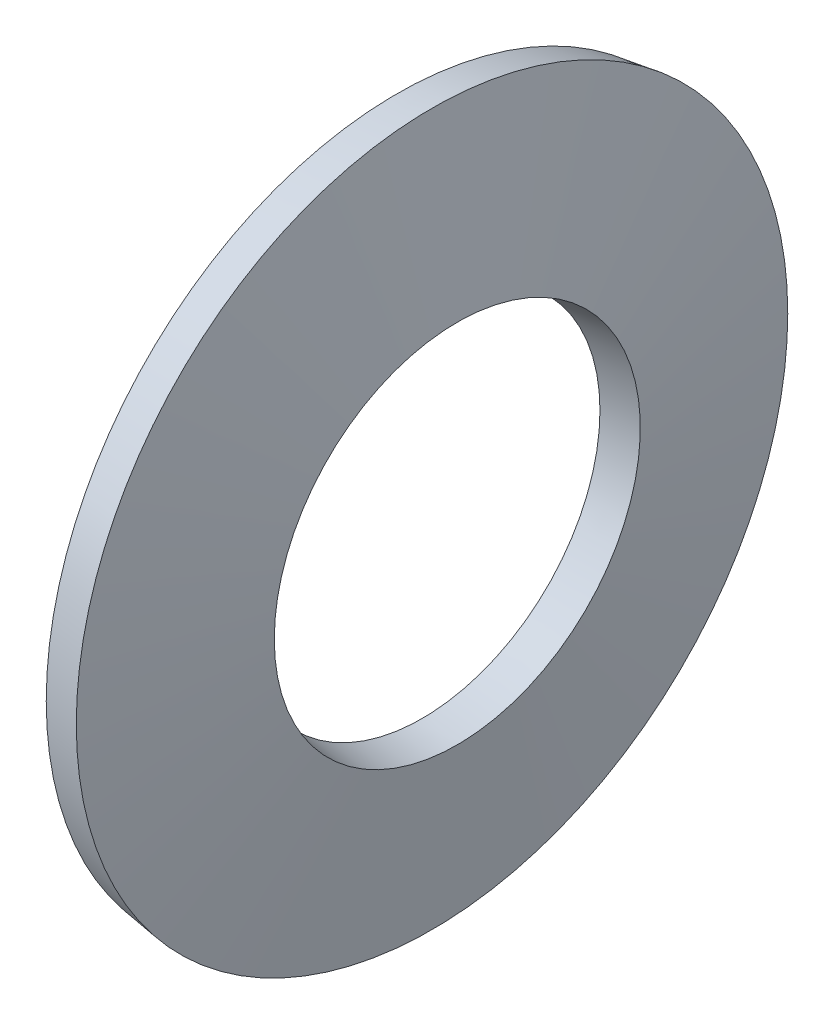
SolidWorks part; units mm, degrees
ref_plane "Plan1" through (0, 0, 0) normal (0, 0, 1) x (1, 0, 0)
ref_plane "Plan2" through (0, 0, 0) normal (0, 1, 0) x (1, 0, 0)
ref_plane "Plan3" through (0, 0, 0) normal (1, 0, 0) x (0, 0, -1)
sketch "Esquisse1" plane through (0, 0, 0) normal (0, 0, 1) x (1, 0, 0)
  line L0 (0, 19.7104) -> (1.4211, 10)
  line L1 (1.4211, 10) -> (3.4, 10.2896)
  line L2 (3.4, 10.2896) -> (1.9789, 20)
  line L3 (0, 19.7104) -> (1.9789, 20)
  line L4 (50, 0) -> (-50, 0) construction
  line L5 (0, -50) -> (0, 50) construction
  line L6 (0, 0) -> (30, 0) construction
  dimension "D1" = 10
  dimension "D2" = 20
  dimension "D3" = 2
  dimension "D4" = 3.4
revolve "Base-Révolution" add sketch "Esquisse1" angle 360 about L6
ref_plane "Plan5" through (3.4, 0, 0) normal (1, 0, 0) x (0, 0, -1)
